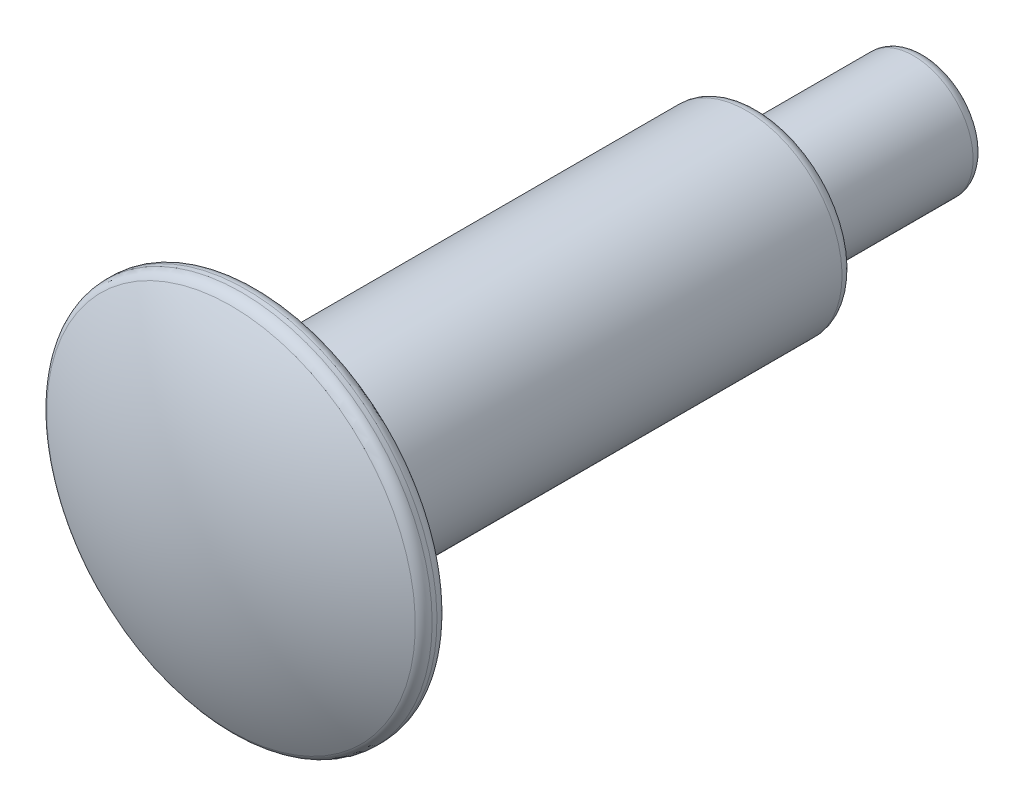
SolidWorks part; units mm, degrees
ref_plane "Спереди" through (0, 0, 0) normal (0, 0, 1) x (1, 0, 0)
ref_plane "Сверху" through (0, 0, 0) normal (0, 1, 0) x (1, 0, 0)
ref_plane "Справа" through (0, 0, 0) normal (1, 0, 0) x (0, 0, -1)
sketch "Эскиз1" plane through (0, 0, 0) normal (1, 0, 0) x (0, 0, -1)
  line L0 (-15.5346, 0) -> (15.5346, 0)
  line L1 (15.5346, 0) -> (15.5346, 2.5)
  line L2 (15.5346, 2.5) -> (8.5346, 2.5)
  line L3 (8.5346, 2.5) -> (8.5346, 4)
  line L4 (8.5346, 4) -> (-12.4654, 4)
  line L5 (-12.4654, 4) -> (-12.4654, 8)
  line L6 (-12.4654, 8) -> (-13.4654, 8)
  arc A0 (-13.4654, 8) -> (-15.5346, 0) centre (0.9654, 0) ccw
  dimension "D7" = 33
  dimension "D1" = 21
  dimension "D2" = 7
  dimension "D3" = 2.5
  dimension "D4" = 4
  dimension "D5" = 8
  dimension "D6" = 1
revolve "Повернуть1" add sketch "Эскиз1" angle 360 about L0
fillet "Скругление1" radius 0.5 6 edges at (0, -2.5, -15.5346) (0, -2.5, -8.5346) (0, -4, -8.5346) (0, -4, 12.4654) (0, -8, 13.4654) (0, -8, 12.4654)
